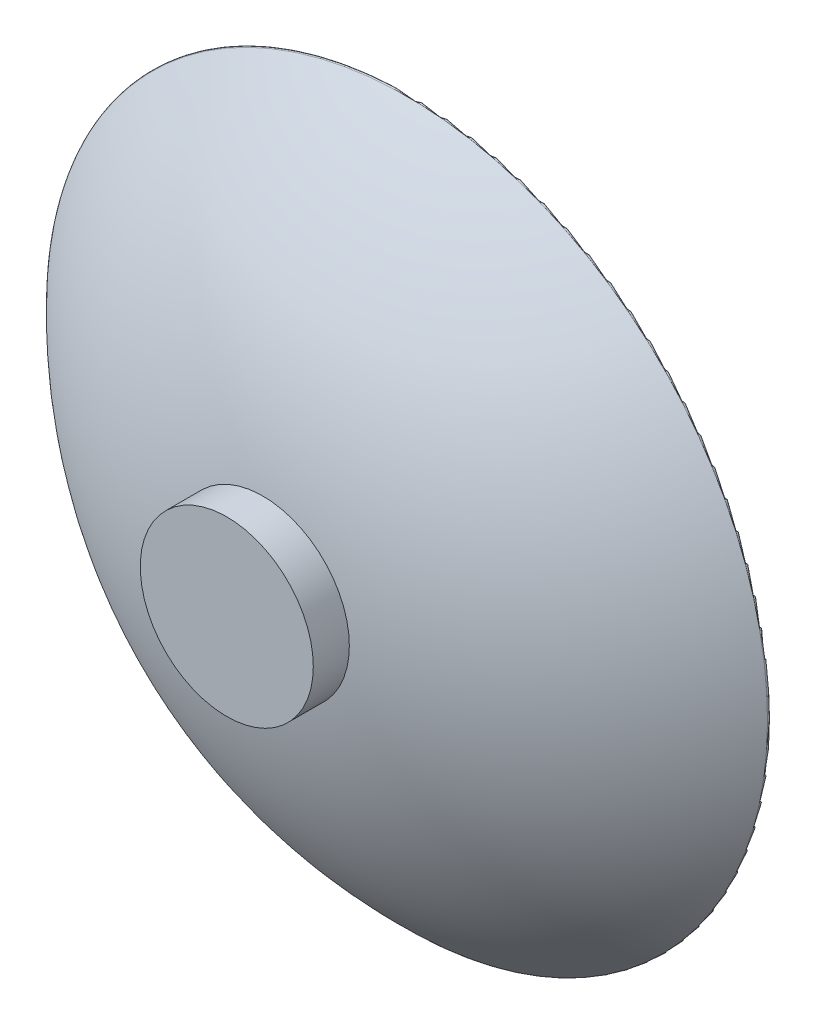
SolidWorks part; units mm, degrees
ref_plane "Alzado" through (0, 0, 0) normal (0, 0, 1) x (1, 0, 0)
ref_plane "Planta" through (0, 0, 0) normal (0, 1, 0) x (1, 0, 0)
ref_plane "Vista lateral" through (0, 0, 0) normal (1, 0, 0) x (0, 0, -1)
sketch "Croquis1" plane through (0, 0, 0) normal (0, 0, 1) x (1, 0, 0)
  circle A0 centre (0, 0) radius 60
  dimension "D1" = 120
extrude "Saliente-Extruir1" add sketch "Croquis1" along normal blind 25
sketch "Croquis2" plane through (0, 0, 0) normal (1, 0, 0) x (0, 0, -1)
  line L0 (0, 0) -> (100, 0) construction
  line L1 (100, 0) -> (100, 250) construction
  line L2 (1.9978, 0.0932) -> (1.9978, 0)
  line L3 (1.9978, 0) -> (0, 0)
  line L4 (11.6805, 95.0216) -> (11.4609, 94.1562)
  line L5 (44.7545, 176.3525) -> (44.3099, 175.5783)
  arc A0 (0, 0) -> (100, 250) centre (324.6471, 15.1412) cw
  arc A1 (1.9978, 0.0932) -> (1.6565, 12.6807) centre (324.6471, 15.1412) cw
  arc A3 (100, 250) -> (101.3824, 248.5547) centre (100.6912, 249.2774) cw
  arc A4 (101.3824, 248.5547) -> (98.5091, 245.772) centre (99.9435, 247.1657) cw
  arc A5 (97.8724, 245.146) -> (95.0415, 242.3201) centre (96.4547, 243.7353) cw
  arc A6 (94.4144, 241.6845) -> (91.6266, 238.8161) centre (93.0182, 240.2526) cw
  arc A7 (91.0093, 238.1711) -> (88.2652, 235.2607) centre (89.6349, 236.7181) cw
  arc A8 (87.6577, 234.6065) -> (84.9581, 231.6548) centre (86.3055, 233.1328) cw
  arc A9 (84.3605, 230.9915) -> (81.7059, 227.9993) centre (83.0308, 229.4975) cw
  arc A10 (81.1185, 227.3269) -> (78.5095, 224.2949) centre (79.8116, 225.813) cw
  arc A11 (77.9323, 223.6137) -> (75.3696, 220.5425) centre (76.6485, 222.0802) cw
  arc A12 (74.8028, 219.8527) -> (72.2869, 216.743) centre (73.5423, 218.2999) cw
  arc A13 (71.7306, 216.0447) -> (69.262, 212.8972) centre (70.4938, 214.473) cw
  arc A14 (68.7164, 212.1906) -> (66.2958, 209.0061) centre (67.5035, 210.6003) cw
  arc A15 (65.7609, 208.2912) -> (63.3889, 205.0705) centre (64.5723, 206.6828) cw
  arc A16 (62.8649, 204.3476) -> (60.5419, 201.0912) centre (61.7008, 202.7213) cw
  arc A17 (60.0289, 200.3605) -> (57.7555, 197.0694) centre (58.8895, 198.7168) cw
  arc A18 (57.2536, 196.3309) -> (55.0304, 193.0057) centre (56.1393, 194.6701) cw
  arc A19 (54.5397, 192.2598) -> (52.3671, 188.9013) centre (53.4507, 190.5823) cw
  arc A20 (51.8878, 188.148) -> (49.7663, 184.757) centre (50.8243, 186.4542) cw
  arc A21 (49.2985, 183.9965) -> (47.2285, 180.5737) centre (48.2607, 182.2868) cw
  arc A22 (46.7723, 179.8063) -> (44.7545, 176.3525) centre (45.7606, 178.081) cw
  arc A23 (44.3099, 175.5783) -> (42.3446, 172.0944) centre (43.3245, 173.8379) cw
  arc A24 (41.9119, 171.3134) -> (39.9996, 167.8002) centre (40.9529, 169.5583) cw
  arc A25 (39.5787, 167.0128) -> (37.7198, 163.4709) centre (38.6464, 165.2433) cw
  arc A26 (37.3109, 162.6772) -> (35.5059, 159.1077) centre (36.4055, 160.8939) cw
  arc A27 (35.109, 158.3079) -> (33.3583, 154.7114) centre (34.2308, 156.511) cw
  arc A28 (32.9736, 153.9056) -> (31.2776, 150.283) centre (32.1227, 152.0957) cw
  arc A29 (30.9052, 149.4716) -> (29.2642, 145.8237) centre (30.0817, 147.649) cw
  arc A30 (28.9041, 145.0067) -> (27.3185, 141.3344) centre (28.1083, 143.1718) cw
  arc A31 (26.9709, 140.512) -> (25.4411, 136.8161) centre (26.203, 138.6653) cw
  arc A32 (25.106, 135.9886) -> (23.6324, 132.2699) centre (24.3662, 134.1304) cw
  arc A33 (23.3098, 131.4374) -> (21.8927, 127.6968) centre (22.5982, 129.5682) cw
  arc A34 (21.5827, 126.8595) -> (20.2225, 123.0979) centre (20.8996, 124.9798) cw
  arc A35 (19.9253, 122.256) -> (18.6221, 118.4742) centre (19.2706, 120.3662) cw
  arc A36 (18.3377, 117.6279) -> (17.092, 113.8268) centre (17.7118, 115.7284) cw
  arc A37 (16.8204, 112.9763) -> (15.6325, 109.1568) centre (16.2233, 111.0675) cw
  arc A38 (15.3738, 108.3023) -> (14.2438, 104.4652) centre (14.8057, 106.3847) cw
  arc A39 (13.9981, 103.6068) -> (12.9264, 99.7531) centre (13.4591, 101.6808) cw
  arc A40 (12.6937, 98.8911) -> (11.6805, 95.0216) centre (12.1839, 96.9572) cw
  arc A41 (11.4609, 94.1562) -> (10.5064, 90.2717) centre (10.9805, 92.2147) cw
  arc A42 (10.2999, 89.4031) -> (9.4044, 85.5046) centre (9.849, 87.4546) cw
  arc A43 (9.2111, 84.633) -> (8.3747, 80.7214) centre (8.7897, 82.6779) cw
  arc A44 (8.1946, 79.8469) -> (7.4176, 75.9231) centre (7.803, 77.8857) cw
  arc A45 (7.2508, 75.046) -> (6.5333, 71.1109) centre (6.8889, 73.079) cw
  arc A46 (6.3798, 70.2314) -> (5.722, 66.2858) centre (6.0477, 68.2591) cw
  arc A47 (5.5819, 65.4041) -> (4.9839, 61.449) centre (5.2797, 63.427) cw
  arc A48 (4.8571, 60.5653) -> (4.3191, 56.6016) centre (4.5849, 58.5839) cw
  arc A49 (4.2057, 55.716) -> (3.7278, 51.7447) centre (3.9636, 53.7307) cw
  arc A50 (3.6279, 50.8574) -> (3.2102, 46.8793) centre (3.4158, 48.8687) cw
  arc A51 (3.1237, 45.9907) -> (2.7663, 42.0067) centre (2.9418, 43.999) cw
  arc A52 (2.6933, 41.1169) -> (2.3963, 37.1279) centre (2.5416, 39.1226) cw
  arc A53 (2.3368, 36.2371) -> (2.1002, 32.2441) centre (2.2153, 34.2407) cw
  arc A54 (2.0542, 31.3524) -> (1.8782, 27.3563) centre (1.9629, 29.3545) cw
  arc A55 (1.8456, 26.4641) -> (1.7302, 22.4657) centre (1.7847, 24.465) cw
  arc A56 (1.7112, 21.5731) -> (1.6563, 17.5735) centre (1.6805, 19.5733) cw
  arc A57 (1.6508, 16.6807) -> (1.6565, 12.6807) centre (1.6504, 14.6807) cw
  arc A58 (1.6508, 16.6807) -> (1.6563, 17.5735) centre (324.6471, 15.1412) cw
  arc A59 (1.9978, 0.0932) -> (101.3824, 248.5547) centre (324.6471, 15.1412) cw construction
  arc A60 (1.7112, 21.5731) -> (1.7302, 22.4657) centre (324.6471, 15.1412) cw
  arc A61 (1.8456, 26.4641) -> (1.8782, 27.3563) centre (324.6471, 15.1412) cw
  arc A62 (2.0542, 31.3524) -> (2.1002, 32.2441) centre (324.6471, 15.1412) cw
  arc A63 (2.3368, 36.2371) -> (2.3963, 37.1279) centre (324.6471, 15.1412) cw
  arc A64 (2.6933, 41.1169) -> (2.7663, 42.0067) centre (324.6471, 15.1412) cw
  arc A65 (3.1237, 45.9907) -> (3.2102, 46.8793) centre (324.6471, 15.1412) cw
  arc A66 (3.6279, 50.8574) -> (3.7278, 51.7447) centre (324.6471, 15.1412) cw
  arc A67 (4.2057, 55.716) -> (4.3191, 56.6016) centre (324.6471, 15.1412) cw
  arc A68 (4.8571, 60.5653) -> (4.9839, 61.449) centre (324.6471, 15.1412) cw
  arc A69 (5.5819, 65.4041) -> (5.722, 66.2858) centre (324.6471, 15.1412) cw
  arc A70 (6.3798, 70.2314) -> (6.5333, 71.1109) centre (324.6471, 15.1412) cw
  arc A71 (7.2508, 75.046) -> (7.4176, 75.9231) centre (324.6471, 15.1412) cw
  arc A72 (8.1946, 79.8469) -> (8.3747, 80.7214) centre (324.6471, 15.1412) cw
  arc A73 (9.2111, 84.633) -> (9.4044, 85.5046) centre (324.6471, 15.1412) cw
  arc A74 (10.2999, 89.4031) -> (10.5064, 90.2717) centre (324.6471, 15.1412) cw
  arc A75 (12.6937, 98.8911) -> (12.9264, 99.7531) centre (324.6471, 15.1412) cw
  arc A76 (13.9981, 103.6068) -> (14.2438, 104.4652) centre (324.6471, 15.1412) cw
  arc A77 (15.3738, 108.3023) -> (15.6325, 109.1568) centre (324.6471, 15.1412) cw
  arc A78 (16.8204, 112.9763) -> (17.092, 113.8268) centre (324.6471, 15.1412) cw
  arc A79 (18.3377, 117.6279) -> (18.6221, 118.4742) centre (324.6471, 15.1412) cw
  arc A80 (19.9253, 122.256) -> (20.2225, 123.0979) centre (324.6471, 15.1412) cw
  arc A81 (23.3098, 131.4374) -> (23.6324, 132.2699) centre (324.6471, 15.1412) cw
  arc A82 (21.5827, 126.8595) -> (21.8927, 127.6968) centre (324.6471, 15.1412) cw
  arc A83 (26.9709, 140.512) -> (27.3185, 141.3344) centre (324.6471, 15.1412) cw
  arc A84 (25.106, 135.9886) -> (25.4411, 136.8161) centre (324.6471, 15.1412) cw
  arc A85 (30.9052, 149.4716) -> (31.2776, 150.283) centre (324.6471, 15.1412) cw
  arc A86 (28.9041, 145.0067) -> (29.2642, 145.8237) centre (324.6471, 15.1412) cw
  arc A87 (32.9736, 153.9056) -> (33.3583, 154.7114) centre (324.6471, 15.1412) cw
  arc A88 (35.109, 158.3079) -> (35.5059, 159.1077) centre (324.6471, 15.1412) cw
  arc A89 (46.7723, 179.8063) -> (47.2285, 180.5737) centre (324.6471, 15.1412) cw
  arc A90 (41.9119, 171.3134) -> (42.3446, 172.0944) centre (324.6471, 15.1412) cw
  arc A91 (39.5787, 167.0128) -> (39.9996, 167.8002) centre (324.6471, 15.1412) cw
  arc A92 (37.3109, 162.6772) -> (37.7198, 163.4709) centre (324.6471, 15.1412) cw
  arc A93 (49.2985, 183.9965) -> (49.7663, 184.757) centre (324.6471, 15.1412) cw
  arc A94 (51.8878, 188.148) -> (52.3671, 188.9013) centre (324.6471, 15.1412) cw
  arc A95 (54.5397, 192.2598) -> (55.0304, 193.0057) centre (324.6471, 15.1412) cw
  arc A96 (57.2536, 196.3309) -> (57.7555, 197.0694) centre (324.6471, 15.1412) cw
  arc A97 (65.7609, 208.2912) -> (66.2958, 209.0061) centre (324.6471, 15.1412) cw
  arc A98 (62.8649, 204.3476) -> (63.3889, 205.0705) centre (324.6471, 15.1412) cw
  arc A99 (60.0289, 200.3605) -> (60.5419, 201.0912) centre (324.6471, 15.1412) cw
  arc A100 (68.7164, 212.1906) -> (69.262, 212.8972) centre (324.6471, 15.1412) cw
  arc A101 (71.7306, 216.0447) -> (72.2869, 216.743) centre (324.6471, 15.1412) cw
  arc A102 (74.8028, 219.8527) -> (75.3696, 220.5425) centre (324.6471, 15.1412) cw
  arc A103 (77.9323, 223.6137) -> (78.5095, 224.2949) centre (324.6471, 15.1412) cw
  arc A104 (81.1185, 227.3269) -> (81.7059, 227.9993) centre (324.6471, 15.1412) cw
  arc A105 (84.3605, 230.9915) -> (84.9581, 231.6548) centre (324.6471, 15.1412) cw
  arc A106 (87.6577, 234.6065) -> (88.2652, 235.2607) centre (324.6471, 15.1412) cw
  arc A107 (91.0093, 238.1711) -> (91.6266, 238.8161) centre (324.6471, 15.1412) cw
  arc A108 (97.8724, 245.146) -> (98.5091, 245.772) centre (324.6471, 15.1412) cw
  arc A109 (94.4144, 241.6845) -> (95.0415, 242.3201) centre (324.6471, 15.1412) cw
  point P174 (324.6471, 15.1412)
  dimension "D3" = 325
  dimension "D5" = 2
  dimension "D1" = 100
  dimension "D2" = 250
  dimension "D4" = 2
  dimension "D6" = 54
revolve "Revolución1" add sketch "Croquis2" angle 360 about L0
sketch "Croquis3" plane through (0, 0, 0) normal (1, 0, 0) x (0, 0, -1)
  line L0 (1.3768, 0) -> (101.3768, 0) construction
  arc A0 (1.3768, 0) -> (101.3768, 0) centre (51.3768, 0) cw
  dimension "D1" = 100
revolve "Revolución-Lámina8" add sketch "Croquis3" angle 360 about L0
